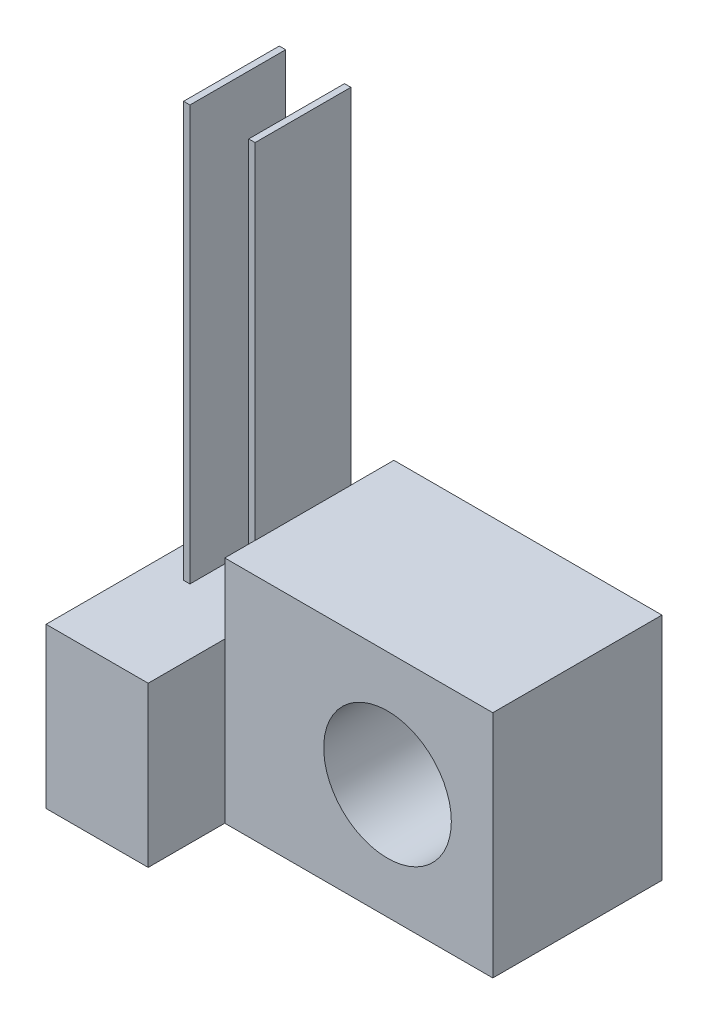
SolidWorks part; units mm, degrees
ref_plane "Plan de face" through (0, 0, 0) normal (0, 0, 1) x (1, 0, 0)
ref_plane "Plan de dessus" through (0, 0, 0) normal (0, 1, 0) x (1, 0, 0)
ref_plane "Plan de droite" through (0, 0, 0) normal (1, 0, 0) x (0, 0, -1)
ref_plane "Plan4" through (0, 0, 2.65) normal (0, 0, 1) x (1, 0, 0)
sketch "Esquisse2" plane through (0, 0, 2.65) normal (0, 0, 1) x (1, 0, 0)
  line L0 (12.1, 55.9996) -> (14.2732, 55.9996) construction
  line L1 (13.75, 57.7996) -> (9.55, 57.7996)
  line L2 (13.75, 57.7996) -> (13.75, 54.1996)
  line L3 (13.75, 54.1996) -> (7.95, 54.1996)
  line L4 (7.95, 56.6996) -> (7.95, 54.1996)
  line L5 (9.55, 57.7996) -> (9.55, 56.6996)
  line L6 (9.55, 56.6996) -> (7.95, 56.6996)
  circle A1 centre (12.1, 55.9996) radius 1
  point P6 (13.75, 55.9996)
  dimension "D1" = 3.6
  dimension "D3" = 4.2
  dimension "D4" = 2.5
  dimension "D5" = 5.8
extrude "Extrusion1" add sketch "Esquisse2" against normal up to body
sketch "Esquisse3" plane through (0, 0, 2.65) normal (0, 0, 1) x (1, 0, 0)
  line L1 (9.55, 56.6996) -> (7.95, 56.6996)
  line L2 (9.55, 56.6996) -> (9.55, 54.1996)
  line L3 (9.55, 54.1996) -> (7.95, 54.1996)
  line L4 (7.95, 56.6996) -> (7.95, 54.1996)
extrude "Extrusion2" add sketch "Esquisse3" along normal blind 1.2
sketch "Esquisse4" plane through (0, 56.6996, 0) normal (0, 1, 0) x (-1, 0, 0)
  line L1 (-9.5516, 0.676) -> (-9.4516, 0.676)
  line L2 (-9.5516, 0.676) -> (-9.5516, 2.176)
  line L3 (-9.5516, 2.176) -> (-9.4516, 2.176)
  line L4 (-9.4516, 0.676) -> (-9.4516, 2.176)
  line L6 (-8.5306, 0.676) -> (-8.4306, 0.676)
  line L7 (-8.5306, 0.676) -> (-8.5306, 2.176)
  line L8 (-8.5306, 2.176) -> (-8.4306, 2.176)
  line L9 (-8.4306, 0.676) -> (-8.4306, 2.176)
  line L10 (-7.95, 1.3655) -> (-10.1507, 1.3655) construction
  dimension "D1" = 1.5
  dimension "D2" = 1.5
  dimension "D3" = 0.1
  dimension "D4" = 0.1
extrude "Extrusion3" add sketch "Esquisse4" along normal blind 6.5
sketch "Esquisse5" plane through (0, 54.1996, 0) normal (0, -1, 0) x (1, 0, 0)
  circle A0 centre (10.1742, 1.7809) radius 0.7
  circle A1 centre (8.6773, 1.7809) radius 0.7
  dimension "D1" = 1.4
